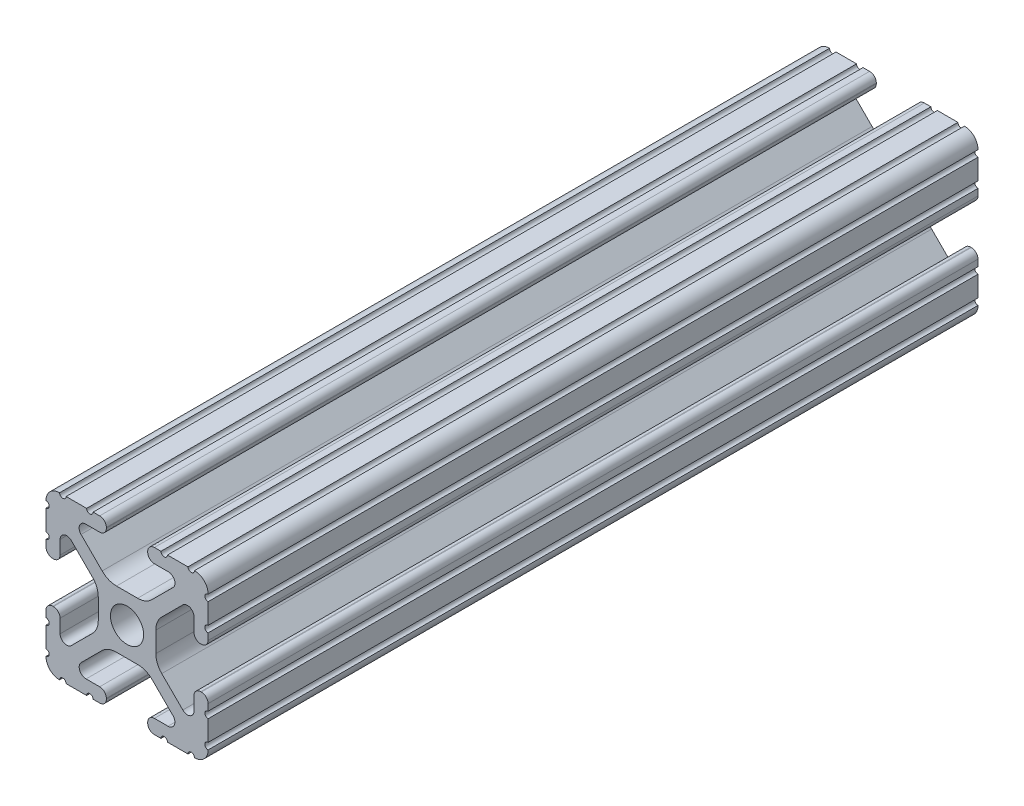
SolidWorks part; units mm, degrees
ref_plane "Front" through (0, 0, 0) normal (0, 0, 1) x (1, 0, 0)
ref_plane "Top" through (0, 0, 0) normal (0, 1, 0) x (1, 0, 0)
ref_plane "Right" through (0, 0, 0) normal (1, 0, 0) x (0, 0, -1)
sketch "Sketch1" plane through (0, 0, 0) normal (0, 0, 1) x (1, 0, 0)
  line L0 (-7.5107, 9.4563) -> (7.5107, 9.4563) construction
  line L1 (-7.4968, -9.4098) -> (7.4968, -9.4098) construction
  line L88 (-7.1797, -8.6452) -> (-3.9523, -5.4237)
  line L89 (-1.7093, -4.4958) -> (1.7093, -4.4958)
  line L90 (3.9523, -5.4237) -> (7.1797, -8.6452)
  line L91 (6.4164, -10.4902) -> (4.2875, -10.4902)
  line L92 (3.2385, -11.5392) -> (3.2385, -11.651)
  line L93 (4.2875, -12.7) -> (5.3171, -12.7)
  line L94 (6.3331, -12.7) -> (9.5504, -12.7)
  line L95 (12.7, -9.5504) -> (12.7, -6.3331)
  line L96 (12.7, -5.3171) -> (12.7, -4.2875)
  line L97 (11.651, -3.2385) -> (11.5392, -3.2385)
  line L98 (10.4902, -4.2875) -> (10.4902, -6.4021)
  line L99 (8.7371, -7.1294) -> (5.441, -3.8408)
  line L100 (4.5085, -1.5932) -> (4.5085, 1.5932)
  line L101 (5.441, 3.8408) -> (8.7371, 7.1294)
  line L102 (10.4902, 6.4021) -> (10.4902, 4.2875)
  line L103 (11.5392, 3.2385) -> (11.651, 3.2385)
  line L104 (12.7, 4.2875) -> (12.7, 5.3171)
  line L105 (12.7, 6.3331) -> (12.7, 9.5504)
  line L106 (9.5504, 12.7) -> (6.3331, 12.7)
  line L107 (5.3171, 12.7) -> (4.2875, 12.7)
  line L108 (3.2385, 11.651) -> (3.2385, 11.5392)
  line L109 (4.2875, 10.4902) -> (6.4768, 10.4902)
  line L110 (7.207, 8.7244) -> (3.8983, 5.4232)
  line L111 (1.6558, 4.4958) -> (-1.6558, 4.4958)
  line L112 (-3.8983, 5.4232) -> (-7.207, 8.7244)
  line L113 (-6.4768, 10.4902) -> (-4.2875, 10.4902)
  line L114 (-3.2385, 11.5392) -> (-3.2385, 11.651)
  line L115 (-4.2875, 12.7) -> (-5.3171, 12.7)
  line L116 (-6.3331, 12.7) -> (-9.5504, 12.7)
  line L117 (-12.7, 9.5504) -> (-12.7, 6.3331)
  line L118 (-12.7, 5.3171) -> (-12.7, 4.2875)
  line L119 (-11.651, 3.2385) -> (-11.5392, 3.2385)
  line L120 (-10.4902, 4.2875) -> (-10.4902, 6.4021)
  line L121 (-8.7371, 7.1294) -> (-5.441, 3.8408)
  line L122 (-4.5085, 1.5932) -> (-4.5085, -1.5932)
  line L123 (-5.441, -3.8408) -> (-8.7371, -7.1294)
  line L124 (-10.4902, -6.4021) -> (-10.4902, -4.2875)
  line L125 (-11.5392, -3.2385) -> (-11.651, -3.2385)
  line L126 (-12.7, -4.2875) -> (-12.7, -5.3171)
  line L127 (-12.7, -6.3331) -> (-12.7, -9.5504)
  line L128 (-9.5504, -12.7) -> (-6.3331, -12.7)
  line L129 (-5.3171, -12.7) -> (-4.2875, -12.7)
  line L130 (-3.2385, -11.651) -> (-3.2385, -11.5392)
  line L131 (-4.2875, -10.4902) -> (-6.4164, -10.4902)
  circle A1 centre (0, 0) radius 2.6035
  arc A104 (-7.1797, -8.6452) -> (-6.4164, -10.4902) centre (-6.4164, -9.4098) ccw
  arc A105 (-1.7093, -4.4958) -> (-3.9523, -5.4237) centre (-1.7093, -7.6708) ccw
  arc A106 (3.9523, -5.4237) -> (1.7093, -4.4958) centre (1.7093, -7.6708) ccw
  arc A107 (6.4164, -10.4902) -> (7.1797, -8.6452) centre (6.4164, -9.4098) ccw
  arc A108 (4.2875, -10.4902) -> (3.2385, -11.5392) centre (4.2875, -11.5392) ccw
  arc A109 (3.2385, -11.651) -> (4.2875, -12.7) centre (4.2875, -11.651) ccw
  arc A110 (6.3331, -12.7) -> (5.3171, -12.7) centre (5.8251, -12.7) ccw
  arc A111 (10.5664, -12.6998) -> (9.5504, -12.7) centre (10.0584, -12.7) ccw
  arc A112 (10.5664, -12.6998) -> (12.6998, -10.5664) centre (10.5918, -10.5918) ccw
  arc A113 (12.7, -9.5504) -> (12.6998, -10.5664) centre (12.7, -10.0584) ccw
  arc A114 (12.7, -5.3171) -> (12.7, -6.3331) centre (12.7, -5.8251) ccw
  arc A115 (12.7, -4.2875) -> (11.651, -3.2385) centre (11.651, -4.2875) ccw
  arc A116 (11.5392, -3.2385) -> (10.4902, -4.2875) centre (11.5392, -4.2875) ccw
  arc A117 (8.7371, -7.1294) -> (10.4902, -6.4021) centre (9.4628, -6.4021) ccw
  arc A118 (4.5085, -1.5932) -> (5.441, -3.8408) centre (7.6835, -1.5932) ccw
  arc A119 (5.441, 3.8408) -> (4.5085, 1.5932) centre (7.6835, 1.5932) ccw
  arc A120 (10.4902, 6.4021) -> (8.7371, 7.1294) centre (9.4628, 6.4021) ccw
  arc A121 (10.4902, 4.2875) -> (11.5392, 3.2385) centre (11.5392, 4.2875) ccw
  arc A122 (11.651, 3.2385) -> (12.7, 4.2875) centre (11.651, 4.2875) ccw
  arc A123 (12.7, 6.3331) -> (12.7, 5.3171) centre (12.7, 5.8251) ccw
  arc A124 (12.6998, 10.5664) -> (12.7, 9.5504) centre (12.7, 10.0584) ccw
  arc A125 (12.6998, 10.5664) -> (10.5664, 12.6998) centre (10.5918, 10.5918) ccw
  arc A126 (9.5504, 12.7) -> (10.5664, 12.6998) centre (10.0584, 12.7) ccw
  arc A127 (5.3171, 12.7) -> (6.3331, 12.7) centre (5.8251, 12.7) ccw
  arc A128 (4.2875, 12.7) -> (3.2385, 11.651) centre (4.2875, 11.651) ccw
  arc A129 (3.2385, 11.5392) -> (4.2875, 10.4902) centre (4.2875, 11.5392) ccw
  arc A130 (7.207, 8.7244) -> (6.4768, 10.4902) centre (6.4768, 9.4563) ccw
  arc A131 (1.6558, 4.4958) -> (3.8983, 5.4232) centre (1.6558, 7.6708) ccw
  arc A132 (-3.8983, 5.4232) -> (-1.6558, 4.4958) centre (-1.6558, 7.6708) ccw
  arc A133 (-6.4768, 10.4902) -> (-7.207, 8.7244) centre (-6.4768, 9.4563) ccw
  arc A134 (-4.2875, 10.4902) -> (-3.2385, 11.5392) centre (-4.2875, 11.5392) ccw
  arc A135 (-3.2385, 11.651) -> (-4.2875, 12.7) centre (-4.2875, 11.651) ccw
  arc A136 (-6.3331, 12.7) -> (-5.3171, 12.7) centre (-5.8251, 12.7) ccw
  arc A137 (-10.5664, 12.6998) -> (-9.5504, 12.7) centre (-10.0584, 12.7) ccw
  arc A138 (-10.5664, 12.6998) -> (-12.6998, 10.5664) centre (-10.5918, 10.5918) ccw
  arc A139 (-12.7, 9.5504) -> (-12.6998, 10.5664) centre (-12.7, 10.0584) ccw
  arc A140 (-12.7, 5.3171) -> (-12.7, 6.3331) centre (-12.7, 5.8251) ccw
  arc A141 (-12.7, 4.2875) -> (-11.651, 3.2385) centre (-11.651, 4.2875) ccw
  arc A142 (-11.5392, 3.2385) -> (-10.4902, 4.2875) centre (-11.5392, 4.2875) ccw
  arc A143 (-8.7371, 7.1294) -> (-10.4902, 6.4021) centre (-9.4628, 6.4021) ccw
  arc A144 (-4.5085, 1.5932) -> (-5.441, 3.8408) centre (-7.6835, 1.5932) ccw
  arc A145 (-5.441, -3.8408) -> (-4.5085, -1.5932) centre (-7.6835, -1.5932) ccw
  arc A146 (-10.4902, -6.4021) -> (-8.7371, -7.1294) centre (-9.4628, -6.4021) ccw
  arc A147 (-10.4902, -4.2875) -> (-11.5392, -3.2385) centre (-11.5392, -4.2875) ccw
  arc A148 (-11.651, -3.2385) -> (-12.7, -4.2875) centre (-11.651, -4.2875) ccw
  arc A149 (-12.7, -6.3331) -> (-12.7, -5.3171) centre (-12.7, -5.8251) ccw
  arc A150 (-12.6998, -10.5664) -> (-12.7, -9.5504) centre (-12.7, -10.0584) ccw
  arc A151 (-12.6998, -10.5664) -> (-10.5664, -12.6998) centre (-10.5918, -10.5918) ccw
  arc A152 (-9.5504, -12.7) -> (-10.5664, -12.6998) centre (-10.0584, -12.7) ccw
  arc A153 (-5.3171, -12.7) -> (-6.3331, -12.7) centre (-5.8251, -12.7) ccw
  arc A154 (-4.2875, -12.7) -> (-3.2385, -11.651) centre (-4.2875, -11.651) ccw
  arc A155 (-3.2385, -11.5392) -> (-4.2875, -10.4902) centre (-4.2875, -11.5392) ccw
extrude "Boss-Extrude1" add sketch "Sketch1" along normal mid plane 120.65
